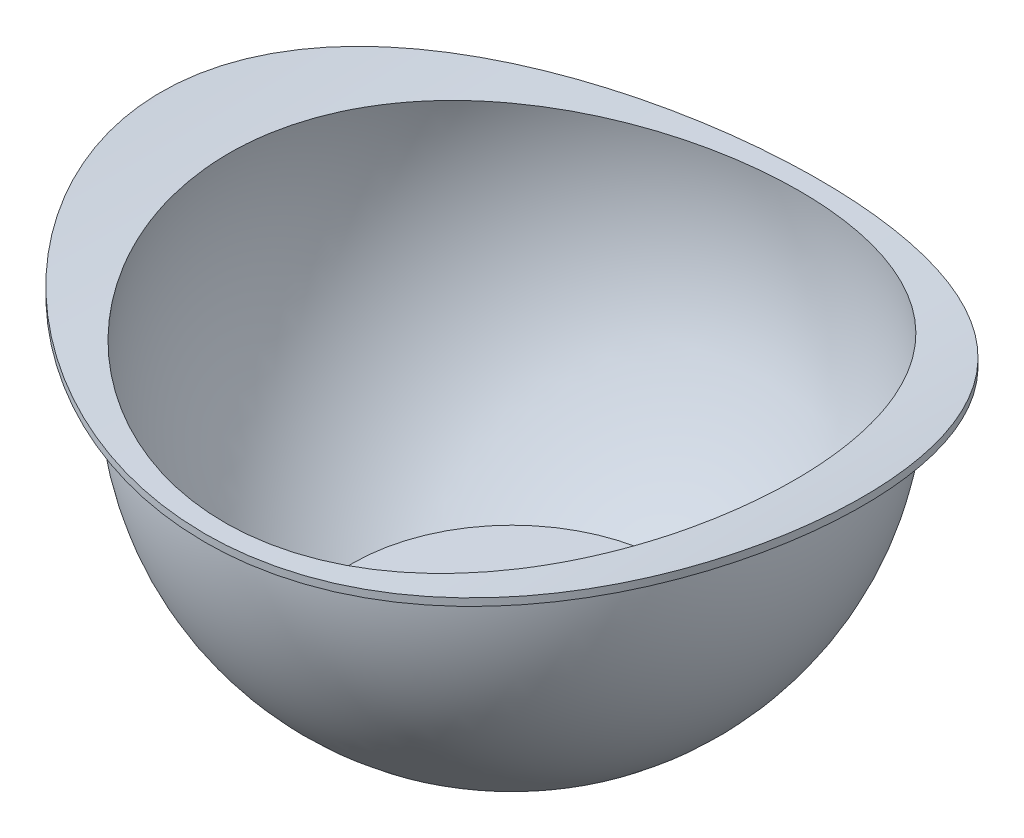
SolidWorks part; units mm, degrees
other "Bowl"
other "Bowl Lip"
ref_plane "Front Plane" through (0, 0, 0) normal (0, 0, 1) x (1, 0, 0)
ref_plane "Top Plane" through (0, 0, 0) normal (0, 1, 0) x (1, 0, 0)
ref_plane "Right Plane" through (0, 0, 0) normal (1, 0, 0) x (0, 0, -1)
sketch "Sketch1" plane through (0, 0, 0) normal (1, 0, 0) x (0, 0, -1)
  line L0 (0, 0) -> (0, 83.5165) construction
  line L1 (0, 0) -> (55, 0)
  arc A0 (55, 0) -> (96.4294, 110) centre (0, 83.5165) ccw
  dimension "D2" = 100
  dimension "D1" = 110
  dimension "D3" = 110
revolve "Revolve-Thin1" add sketch "Sketch1" angle 360 about L0
sketch "Sketch2" plane through (0, 0, 0) normal (0, 0, 1) x (1, 0, 0)
  line L0 (0, 0) -> (0, 90) construction
  arc A0 (-120, 108.4243) -> (120, 108.4243) centre (0, 490) ccw
  dimension "D1" = 400
  dimension "D2" = 90
  dimension "D3" = 240
extrude "Extrude-Thin1" add sketch "Sketch2" along normal mid plane 210 separate body thin
sketch "Sketch3" plane through (0, 0, 0) normal (0, 1, 0) x (1, 0, 0)
  line L2 (120, 105) -> (-120, 105) construction
  line L3 (120, -105) -> (120, 105) construction
  ellipse E0 centre (0, 0) end of major axis (-120, 0) minor radius 105
extrude "Cut-Extrude1" cut sketch "Sketch3" along normal through all flip side to cut
other "Intersect1"
ref_plane "Plane1" through (0, 75, 0) normal (0, 1, 0) x (1, 0, 0)
other "Volume" [suppressed]
